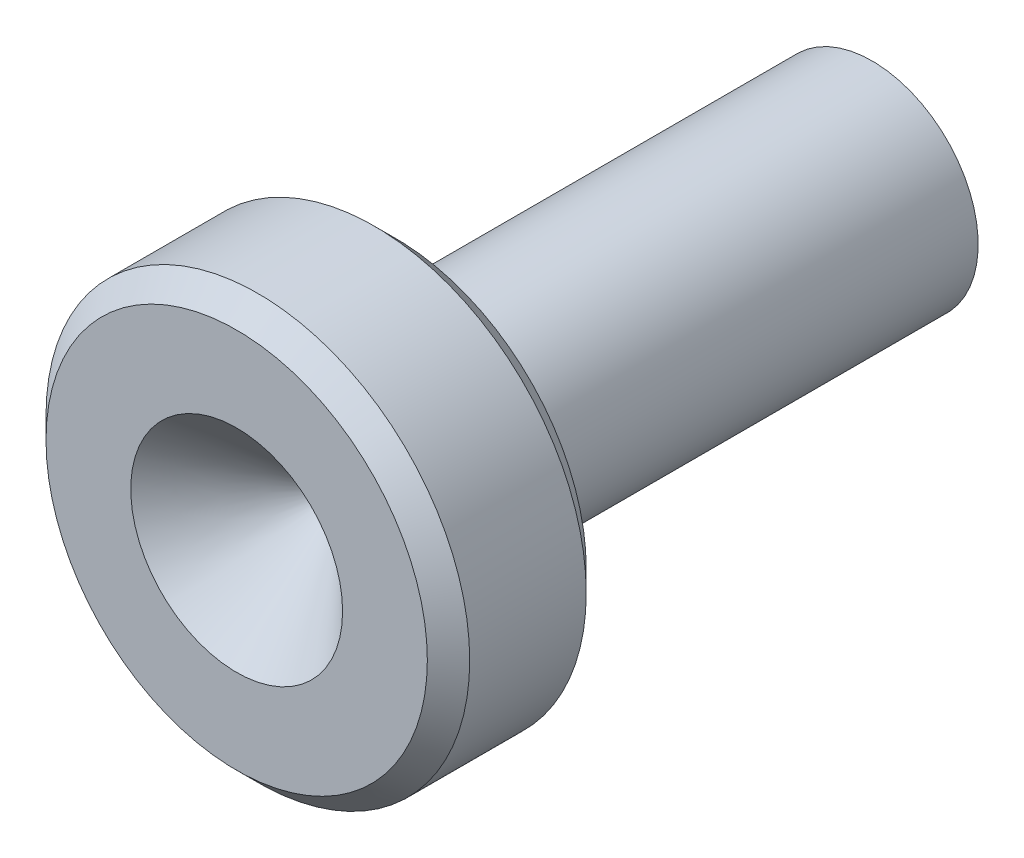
SolidWorks part; units mm, degrees
ref_plane "Plan de face" through (0, 0, 0) normal (0, 0, 1) x (1, 0, 0)
ref_plane "Plan de dessus" through (0, 0, 0) normal (0, 1, 0) x (1, 0, 0)
ref_plane "Plan de droite" through (0, 0, 0) normal (1, 0, 0) x (0, 0, -1)
imported_body "Importée1"
sketch "Esquisse1" plane through (0, 0, -0.45) normal (0, 0, -1) x (-1, 0, 0)
  circle A0 centre (0, 0) radius 10 construction
  circle A1 centre (0, 0) radius 10
extrude "Extrusion2" cut sketch "Esquisse1" against normal blind 0.45
